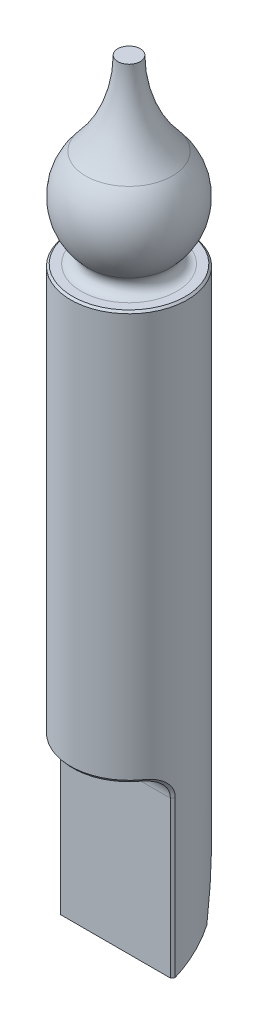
SolidWorks part; units mm, degrees
ref_plane "Спереди" through (0, 0, 0) normal (0, 0, 1) x (1, 0, 0)
ref_plane "Сверху" through (0, 0, 0) normal (0, 1, 0) x (1, 0, 0)
ref_plane "Справа" through (0, 0, 0) normal (1, 0, 0) x (0, 0, -1)
sketch "Эскиз1" plane through (0, 0, 0) normal (0, 0, 1) x (1, 0, 0)
  line L0 (-3, 0) -> (0, 0)
  line L1 (-3, 0) -> (-3, 30)
  line L2 (0, 0) -> (0, 39.2823)
  line L3 (-0.575, 39.2823) -> (0, 39.2823)
  line L4 (-3, 30) -> (-2.4495, 30)
  arc A0 (-2.2219, 35.0157) -> (-2.0996, 30.8571) centre (0, 33) ccw
  arc A1 (-2.2219, 35.0157) -> (-0.575, 39.2823) centre (-6.925, 39.2823) ccw
  arc A2 (-2.4495, 30) -> (-2.0996, 30.8571) centre (-2.4495, 30.5) ccw
  dimension "D3" = 12.7
  dimension "D6" = 1
  dimension "D2" = 3
  dimension "D4" = 0.575
  dimension "D5" = 30
revolve "Повернуть1" add sketch "Эскиз1" angle 360 about L2
sketch "Эскиз3" plane through (0, 0, 0) normal (1, 0, 0) x (0, 0, -1)
  line L0 (-3, 9) -> (-1.7, 9)
  line L4 (0, 0) -> (0, 14.0598) construction
  line L5 (-0.7, 8) -> (-0.7, 0)
  line L7 (-0.38, 0) -> (1.2442, 1.1671)
  line L8 (-3, 0) -> (3, 0) construction
  line L9 (-0.7, 0) -> (-0.38, 0)
  line L11 (3, 0) -> (3, 30) construction
  line L12 (3, 7.6296) -> (3, -1.2164)
  line L13 (3, -1.2164) -> (-3, -1.2164)
  line L14 (-3, -1.2164) -> (-3, 9)
  line L15 (1.2442, 1.1671) -> (3, 7.6296)
  arc A0 (-1.7, 9) -> (-0.7, 8) centre (-1.7, 8) cw
  dimension "D4" = 0.32
  dimension "D3" = 1
  dimension "D1" = 9
  dimension "D2" = 2.3
  dimension "D5" = 35.7
  dimension "D6" = 2
  dimension "D7" = 15.2
  dimension "D8" = 6
extrude "Вырез-Вытянуть1" cut sketch "Эскиз3" against normal mid plane 10
chamfer "Фаска1" distance 0.1 angle 45 8 edges at (0, 30, -3) (2.9662, 0.5959, -0.4492) (-2.9662, 0.5959, -0.4492) (2.9172, 4, 0.7) (-2.9172, 4, 0.7) (1.4786, 7.5861, 2.6103) (-2.8603, 8.6062, 0.9047) (0, 9, 3)
